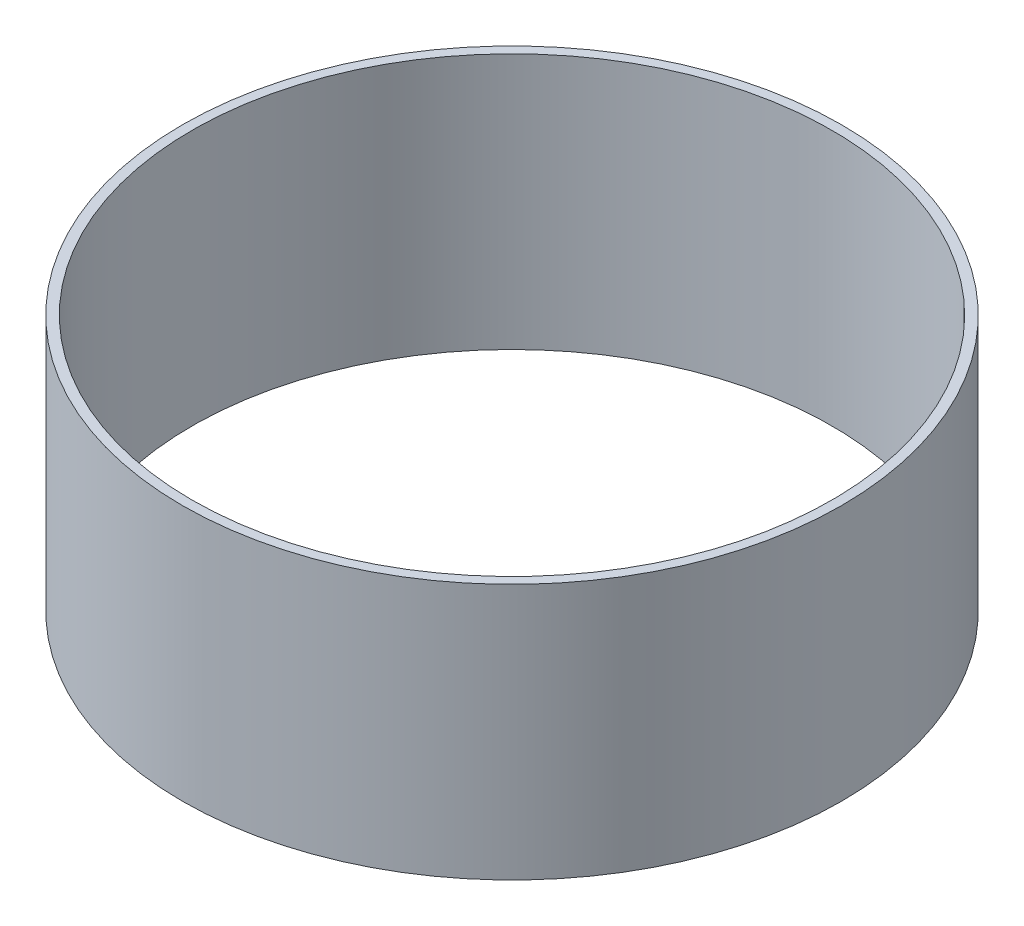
SolidWorks part; units mm, degrees
ref_plane "Front Plane" through (0, 0, 0) normal (0, 0, 1) x (1, 0, 0)
ref_plane "Top Plane" through (0, 0, 0) normal (0, 1, 0) x (1, 0, 0)
ref_plane "Right Plane" through (0, 0, 0) normal (1, 0, 0) x (0, 0, -1)
sketch "Sketch1" plane through (0, 0, 0) normal (0, 1, 0) x (1, 0, 0)
  circle A0 centre (0, 0) radius 65.405
  circle A1 centre (0, 0) radius 63.5
  dimension "D1" = 130.81
  dimension "D2" = 127
extrude "Boss-Extrude1" add sketch "Sketch1" along normal mid plane 50.8
